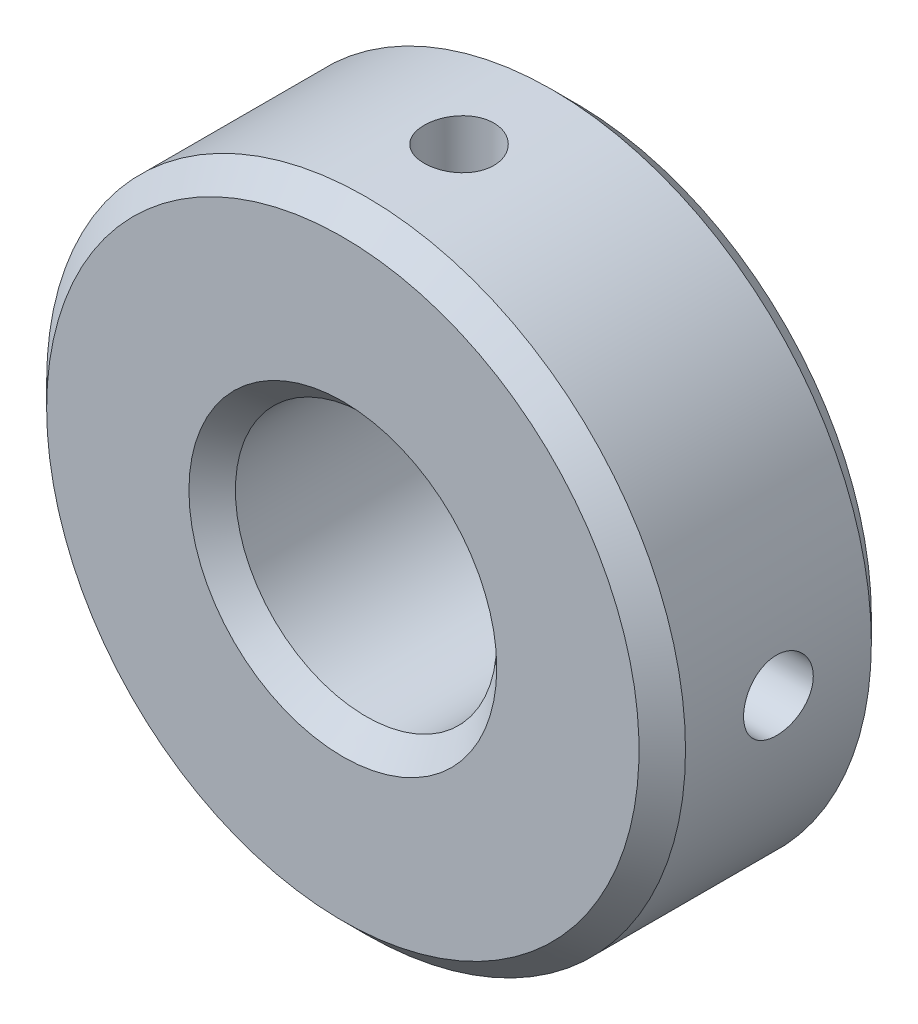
SolidWorks part; units mm, degrees
ref_plane "Front" through (0, 0, 0) normal (0, 0, 1) x (1, 0, 0)
ref_plane "Top" through (0, 0, 0) normal (0, 1, 0) x (1, 0, 0)
ref_plane "Right" through (0, 0, 0) normal (1, 0, 0) x (0, 0, -1)
sketch "Sketch1" plane through (0, 0, 0) normal (0, 0, 1) x (1, 0, 0)
  circle A0 centre (0, 0) radius 11
  circle A1 centre (0, 0) radius 4.5
  dimension "dK" = 22
  dimension "D2" = 9
extrude "BaseNut" add sketch "Sketch1" against normal mid plane 8
ref_plane "Plane1" through (0, 11, 0) normal (0, 1, 0) x (-1, 0, 0)
sketch "Sketch2" plane through (0, 0, 0) normal (0, 0, 1) x (1, 0, 0)
  line L0 (0, 14.609) -> (0, -14.0536) construction
  line L2 (0, 11) -> (1.2001, 11)
  line L5 (1.2001, 11) -> (1.2001, 7.6105)
  line L6 (0, 6.9177) -> (1.2001, 7.6105)
  line L7 (0, 11) -> (0, 6.9177)
  circle A1 centre (0, 0) radius 11 construction
  dimension "t" = 3.3895
  dimension "d1" = 2.4002
  dimension "D2" = 60
revolve "Cut-Revolve2" cut sketch "Sketch2" angle 360 about L0
pattern_circular "CirPattern1" count 4 over 360 about axis through (0, 0, -4) along (0, 0, 1) of "Cut-Revolve2"
chamfer "Chamfer1" distance 0.8 angle 45 4 edges at (4.5, 0, -4) (11, 0, -4) (4.5, 0, 4) (11, 0, 4)
sketch "Sketch3" plane through (0, 0, 0) normal (0, 1, 0) x (1, 0, 0)
  line L0 (0, 7.0838) -> (0, -7.8506) construction
  line L1 (4, 3.45) -> (4.5, 3.45)
  line L2 (4.5, 3.45) -> (4.933, 3.2)
  line L3 (4.933, 3.2) -> (4.5, 2.95)
  line L4 (4.5, 2.95) -> (4, 2.95)
  line L5 (4, 2.95) -> (4, 3.45)
  line L6 (4.5, 3.2) -> (-4.5, 3.2) construction
  dimension "D1" = 0.5
  dimension "D2" = 9
revolve "Cut-Revolve10" [suppressed] cut sketch "Sketch3" angle 360 about L0
pattern_linear "LPattern10" [suppressed] count 13 spacing 0.6 along (0, 0, 1)
equation "\"D2@Sketch3\" = \"D2@Sketch1\""
equation "\"D1@Sketch3\" = (  \"D2@ThreadCosmetic1\" - \"D2@Sketch1\" )  / 2"
equation "\"D3@LPattern10\" = \"D1@Sketch3\" * 1.2"
equation "\"D1@LPattern10\" = \"m@BaseNut\" / \"D3@LPattern10\""
